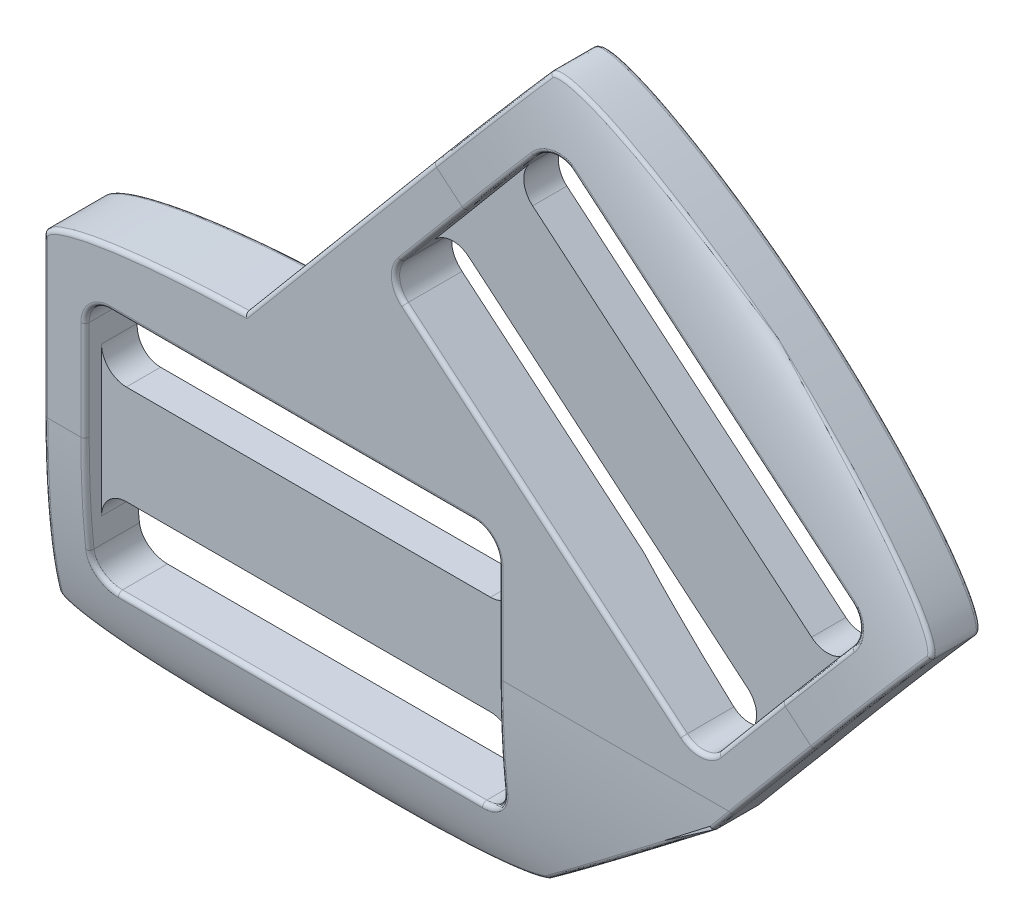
SolidWorks part; units mm, degrees
ref_plane "Ebene vorne" through (0, 0, 0) normal (0, 0, 1) x (1, 0, 0)
ref_plane "Ebene oben" through (0, 0, 0) normal (0, 1, 0) x (1, 0, 0)
ref_plane "Ebene rechts" through (0, 0, 0) normal (1, 0, 0) x (0, 0, -1)
sketch "Skizze1" plane through (0, 0, 0) normal (0, 0, 1) x (1, 0, 0)
  line L0 (24.1058, 7.0242) -> (7.2529, 21.1655)
  line L1 (4.7072, -0.5849) -> (-17.2928, -0.5849)
  line L2 (6.2072, 0.9151) -> (6.2072, 2.4151)
  line L3 (4.7072, 3.9151) -> (-17.2928, 3.9151)
  line L4 (-18.7928, 0.9151) -> (-18.7928, 2.4151)
  line L5 (-17.2928, -6.5849) -> (4.7072, -6.5849)
  line L6 (-18.7928, -8.0849) -> (-18.7928, -9.5849)
  line L7 (-17.2928, -11.0849) -> (4.7072, -11.0849)
  line L8 (6.2072, -8.0849) -> (6.2072, -9.5849)
  line L9 (19.1352, -5.1225) -> (8.217, -13.592)
  line L10 (-21.2928, 7.9151) -> (-21.2928, -15.0849)
  line L11 (-21.2928, -15.0849) -> (8.7072, -15.0849)
  line L12 (8.7072, 7.9151) -> (8.7072, -15.0849)
  line L13 (26.2191, 7.2091) -> (27.1833, 8.3581)
  line L14 (26.9984, 10.4714) -> (10.1454, 24.6127)
  line L15 (7.068, 23.2787) -> (8.0322, 24.4278)
  line L16 (3.3961, 16.5692) -> (20.2491, 2.4279)
  line L17 (1.2829, 16.3843) -> (0.3187, 15.2353)
  line L18 (0.5036, 13.122) -> (17.3566, -1.0193)
  line L19 (20.434, 0.3147) -> (19.4698, -0.8344)
  line L20 (9.6524, 30.248) -> (32.6337, 10.9644)
  line L21 (9.6524, 30.248) -> (-5.1317, 12.629)
  line L23 (32.6337, 10.9644) -> (17.8496, -6.6546)
  line L25 (-5.1317, 12.629) -> (-9.1172, 7.8793)
  arc A0 (4.7072, -11.0849) -> (6.2072, -9.5849) centre (4.7072, -9.5849) ccw
  arc A1 (4.7072, -6.5849) -> (6.2072, -8.0849) centre (4.7072, -8.0849) cw
  arc A2 (-18.7928, -9.5849) -> (-17.2928, -11.0849) centre (-17.2928, -9.5849) ccw
  arc A3 (-17.2928, -6.5849) -> (-18.7928, -8.0849) centre (-17.2928, -8.0849) ccw
  arc A4 (4.7072, -0.5849) -> (6.2072, 0.9151) centre (4.7072, 0.9151) ccw
  arc A5 (6.2072, 2.4151) -> (4.7072, 3.9151) centre (4.7072, 2.4151) ccw
  arc A6 (-17.2928, 3.9151) -> (-18.7928, 2.4151) centre (-17.2928, 2.4151) ccw
  arc A7 (-17.2928, -0.5849) -> (-18.7928, 0.9151) centre (-17.2928, 0.9151) cw
  arc A8 (17.3566, -1.0193) -> (19.4698, -0.8344) centre (18.3207, 0.1298) ccw
  arc A9 (20.2491, 2.4279) -> (20.434, 0.3147) centre (19.2849, 1.2788) cw
  arc A10 (0.3187, 15.2353) -> (0.5036, 13.122) centre (1.4678, 14.2711) ccw
  arc A11 (3.3961, 16.5692) -> (1.2829, 16.3843) centre (2.4319, 15.4202) ccw
  arc A12 (24.1058, 7.0242) -> (26.2191, 7.2091) centre (25.07, 8.1732) ccw
  arc A13 (27.1833, 8.3581) -> (26.9984, 10.4714) centre (26.0342, 9.3223) ccw
  arc A14 (10.1454, 24.6127) -> (8.0322, 24.4278) centre (9.1812, 23.4636) ccw
  arc A15 (7.2529, 21.1655) -> (7.068, 23.2787) centre (8.217, 22.3146) cw
  ellipse E0 centre (-6.2928, 5.9151) end of major axis (-21.2928, 5.9151) minor radius 2 (-6.2928, 7.9151) -> (-21.2928, 5.9151) ccw
  ellipse E2 centre (-6.2928, -13.0849) end of major axis (-21.2928, -13.0849) minor radius 2 (-6.2928, -15.0849) -> (-21.2928, -13.0849) cw
  ellipse E3 centre (-6.2928, -13.0849) end of major axis (8.7072, -13.0849) minor radius 2 (-6.2928, -15.0849) -> (8.7072, -13.0849) ccw
  ellipse E4 centre (19.8575, 19.0741) end of major axis (8.3668, 28.7159) minor radius 2 (21.143, 20.6062) -> (8.3668, 28.7159) ccw
  ellipse E5 centre (19.8575, 19.0741) end of major axis (8.3668, 28.7159) minor radius 2 (21.143, 20.6062) -> (31.3481, 9.4323) cw
  point P11 (6.2072, -11.0849)
  point P14 (6.2072, -6.5849)
  point P17 (-18.7928, -11.0849)
  point P22 (6.2072, -0.5849)
  point P25 (6.2072, 3.9151)
  point P28 (-18.7928, 3.9151)
  point P35 (-21.2928, 5.9151)
  point P36 (8.7072, 5.9151)
  point P37 (-6.2928, 7.9151)
  point P38 (-6.2928, -15.0849)
  point P39 (-21.2928, -13.0849)
  point P40 (8.7072, -13.0849)
  point P92 (8.3668, 28.7159)
  point P93 (31.3481, 9.4323)
  point P94 (21.143, 20.6062)
  point P95 (6.3589, 2.9872)
  point P96 (-3.8462, 14.1611)
  point P97 (19.1352, -5.1225)
  dimension "D6" = 1.5
  dimension "D17" = 1.5
  dimension "D31" = 5.5
  dimension "D1" = 4.5
  dimension "D2" = 4.5
  dimension "D3" = 25
  dimension "D4" = 25
  dimension "D5" = 6
  dimension "D8" = 4
  dimension "D9" = 2.5
  dimension "D10" = 2.5
  dimension "D11" = 2
  dimension "D12" = 2
  dimension "D13" = 2
  dimension "D14" = 2
  dimension "D15" = 2.5
  dimension "D16" = 6
  dimension "D18" = 4
  dimension "D20" = 2.5
  dimension "D21" = 2.5
  dimension "D22" = 2
  dimension "D23" = 2
  dimension "D24" = 2
  dimension "D25" = 2
  dimension "D26" = 2.5
  dimension "D27" = 2.5
  dimension "D28" = 4.5
  dimension "D29" = 4.5
sketch "Skizze2" plane through (0, 0, 0) normal (0, 0, 1) x (1, 0, 0)
  line L0 (24.1058, 7.0242) -> (7.2529, 21.1655)
  line L1 (4.7072, -0.5849) -> (-17.2928, -0.5849)
  line L2 (6.2072, 0.9151) -> (6.2072, 2.4151)
  line L3 (4.7072, 3.9151) -> (-17.2928, 3.9151)
  line L4 (-18.7928, 0.9151) -> (-18.7928, 2.4151)
  line L5 (-17.2928, -6.5849) -> (4.7072, -6.5849)
  line L6 (-18.7928, -8.0849) -> (-18.7928, -9.5849)
  line L7 (-17.2928, -11.0849) -> (4.7072, -11.0849)
  line L8 (6.2072, -8.0849) -> (6.2072, -9.5849)
  line L9 (-21.2928, 7.9151) -> (8.7072, 7.9151)
  line L10 (-21.2928, 7.9151) -> (-21.2928, -15.0849)
  line L11 (-21.2928, -15.0849) -> (8.7072, -15.0849)
  line L12 (8.7072, 7.9151) -> (8.7072, -15.0849)
  line L13 (26.2191, 7.2091) -> (27.1833, 8.3581)
  line L14 (26.9984, 10.4714) -> (10.1454, 24.6127)
  line L15 (7.068, 23.2787) -> (8.0322, 24.4278)
  line L16 (3.3961, 16.5692) -> (20.2491, 2.4279)
  line L17 (1.2829, 16.3843) -> (0.3187, 15.2353)
  line L18 (0.5036, 13.122) -> (17.3566, -1.0193)
  line L19 (20.434, 0.3147) -> (19.4698, -0.8344)
  line L20 (9.6524, 30.248) -> (32.6337, 10.9644)
  line L21 (9.6524, 30.248) -> (-5.1317, 12.629)
  line L22 (-5.1317, 12.629) -> (17.8496, -6.6546)
  line L23 (32.6337, 10.9644) -> (17.8496, -6.6546)
  line L24 (8.7072, -13.0849) -> (19.1352, -5.1225)
  line L25 (-5.1317, 12.629) -> (-9.1172, 7.8793)
  arc A0 (4.7072, -11.0849) -> (6.2072, -9.5849) centre (4.7072, -9.5849) ccw
  arc A1 (4.7072, -6.5849) -> (6.2072, -8.0849) centre (4.7072, -8.0849) cw
  arc A2 (-18.7928, -9.5849) -> (-17.2928, -11.0849) centre (-17.2928, -9.5849) ccw
  arc A3 (-17.2928, -6.5849) -> (-18.7928, -8.0849) centre (-17.2928, -8.0849) ccw
  arc A4 (4.7072, -0.5849) -> (6.2072, 0.9151) centre (4.7072, 0.9151) ccw
  arc A5 (6.2072, 2.4151) -> (4.7072, 3.9151) centre (4.7072, 2.4151) ccw
  arc A6 (-17.2928, 3.9151) -> (-18.7928, 2.4151) centre (-17.2928, 2.4151) ccw
  arc A7 (-17.2928, -0.5849) -> (-18.7928, 0.9151) centre (-17.2928, 0.9151) cw
  arc A8 (17.3566, -1.0193) -> (19.4698, -0.8344) centre (18.3207, 0.1298) ccw
  arc A9 (20.2491, 2.4279) -> (20.434, 0.3147) centre (19.2849, 1.2788) cw
  arc A10 (0.3187, 15.2353) -> (0.5036, 13.122) centre (1.4678, 14.2711) ccw
  arc A11 (3.3961, 16.5692) -> (1.2829, 16.3843) centre (2.4319, 15.4202) ccw
  arc A12 (24.1058, 7.0242) -> (26.2191, 7.2091) centre (25.07, 8.1732) ccw
  arc A13 (27.1833, 8.3581) -> (26.9984, 10.4714) centre (26.0342, 9.3223) ccw
  arc A14 (10.1454, 24.6127) -> (8.0322, 24.4278) centre (9.1812, 23.4636) ccw
  arc A15 (7.2529, 21.1655) -> (7.068, 23.2787) centre (8.217, 22.3146) cw
  ellipse E0 centre (-6.2928, 5.9151) end of major axis (-21.2928, 5.9151) minor radius 2 (-6.2928, 7.9151) -> (-21.2928, 5.9151) ccw
  ellipse E1 centre (-6.2928, 5.9151) end of major axis (8.7072, 5.9151) minor radius 2 (-6.2928, 7.9151) -> (8.7072, 5.9151) cw
  ellipse E2 centre (-6.2928, -13.0849) end of major axis (-21.2928, -13.0849) minor radius 2 (-6.2928, -15.0849) -> (-21.2928, -13.0849) cw
  ellipse E3 centre (-6.2928, -13.0849) end of major axis (8.7072, -13.0849) minor radius 2 (-6.2928, -15.0849) -> (8.7072, -13.0849) ccw
  ellipse E4 centre (19.8575, 19.0741) end of major axis (8.3668, 28.7159) minor radius 2 (21.143, 20.6062) -> (8.3668, 28.7159) ccw
  ellipse E5 centre (19.8575, 19.0741) end of major axis (8.3668, 28.7159) minor radius 2 (21.143, 20.6062) -> (31.3481, 9.4323) cw
  ellipse E6 centre (7.6445, 4.5193) end of major axis (-3.8462, 14.1611) minor radius 2 (6.3589, 2.9872) -> (-3.8462, 14.1611) cw
  ellipse E7 centre (7.6445, 4.5193) end of major axis (-3.8462, 14.1611) minor radius 2 (6.3589, 2.9872) -> (19.1352, -5.1225) ccw
  point P11 (6.2072, -11.0849)
  point P14 (6.2072, -6.5849)
  point P17 (-18.7928, -11.0849)
  point P22 (6.2072, -0.5849)
  point P25 (6.2072, 3.9151)
  point P28 (-18.7928, 3.9151)
  point P35 (-21.2928, 5.9151)
  point P36 (8.7072, 5.9151)
  point P37 (-6.2928, 7.9151)
  point P38 (-6.2928, -15.0849)
  point P39 (-21.2928, -13.0849)
  point P40 (8.7072, -13.0849)
  point P92 (8.3668, 28.7159)
  point P93 (31.3481, 9.4323)
  point P94 (21.143, 20.6062)
  point P95 (6.3589, 2.9872)
  point P96 (-3.8462, 14.1611)
  point P97 (19.1352, -5.1225)
  dimension "D6" = 1.5
  dimension "D17" = 1.5
  dimension "D31" = 5.5
  dimension "D1" = 4.5
  dimension "D2" = 4.5
  dimension "D3" = 25
  dimension "D4" = 25
  dimension "D5" = 6
  dimension "D7" = 4
  dimension "D8" = 4
  dimension "D9" = 2.5
  dimension "D10" = 2.5
  dimension "D11" = 2
  dimension "D12" = 2
  dimension "D13" = 2
  dimension "D14" = 2
  dimension "D15" = 2.5
  dimension "D16" = 6
  dimension "D18" = 4
  dimension "D19" = 4
  dimension "D20" = 2.5
  dimension "D21" = 2.5
  dimension "D22" = 2
  dimension "D23" = 2
  dimension "D24" = 2
  dimension "D25" = 2
  dimension "D26" = 2.5
  dimension "D27" = 2.5
  dimension "D28" = 4.5
  dimension "D29" = 4.5
  dimension "D30" = 50
extrude "Aufsatz-Linear austragen4" add sketch "Skizze1" along normal blind 5
sketch "Skizze4" plane through (0, 0, 5) normal (0, 0, 1) x (1, 0, 0)
  line L0 (-18.7928, 0.9151) -> (-18.7928, 2.4151) construction
  line L1 (-18.7928, 1.6651) -> (6.2072, 1.6651)
  line L2 (-18.7928, 1.6651) -> (-18.7928, -8.8349)
  line L3 (-18.7928, -8.8349) -> (6.2072, -8.8349)
  line L4 (6.2072, 1.6651) -> (6.2072, -8.8349)
  line L5 (6.2072, -8.0849) -> (6.2072, -9.5849) construction
  line L6 (7.5501, 23.8533) -> (26.7012, 7.7836)
  line L7 (7.068, 23.2787) -> (8.0322, 24.4278) construction
  line L8 (26.2191, 7.2091) -> (27.1833, 8.3581) construction
  line L9 (26.7012, 7.7836) -> (19.9519, -0.2599)
  line L10 (20.434, 0.3147) -> (19.4698, -0.8344) construction
  line L11 (19.9519, -0.2599) -> (0.8008, 15.8098)
  line L12 (1.2829, 16.3843) -> (0.3187, 15.2353) construction
  line L13 (0.8008, 15.8098) -> (7.5501, 23.8533)
extrude "Schnitt-Linear austragen1" cut sketch "Skizze4" against normal blind 1
sketch "Skizze5" plane through (-9.23, 7.7449, 0) normal (-0.766, 0.6428, 0) x (0, 0, 1)
  line L0 (0, 29.3758) -> (0, 6.3758)
  line L1 (0, 29.3758) -> (0, 6.3758) construction
  line L2 (0, 29.3758) -> (5, 29.3758)
  line L3 (5, 29.3758) -> (5, 6.3758)
  line L4 (5, 6.3758) -> (0, 6.3758)
  ellipse E0 centre (0, 17.8758) end of major axis (0, 29.3758) minor radius 2 (0, 29.3758) -> (0, 6.3758) cw
  ellipse E1 centre (3, 17.8758) end of major axis (3, 29.3758) minor radius 2 (3, 29.3758) -> (5, 17.8758) cw
  point P5 (2, 17.8758)
  point P7 (3, 29.3758)
  point P14 (3, 17.8758)
  dimension "D1" = 2
  dimension "D2" = 5
  dimension "D3" = 2
extrude "Schnitt-Linear austragen2" cut sketch "Skizze5" against normal blind 40 contours E0 M6 M3 | E0 L0 M6 | L2 E1 L3 M6 | E1 L3 M6
sketch "Skizze6" plane through (-21.2928, 0, 0) normal (-1, 0, 0) x (0, 0, 1)
  line L0 (0, 7.9151) -> (0, -15.0849)
  line L1 (0, 7.9151) -> (0, -15.0849) construction
  line L2 (0, -15.0849) -> (5, -15.0849)
  line L3 (5, -15.0849) -> (5, 7.9151)
  line L4 (5, 7.9151) -> (0, 7.9151)
  ellipse E0 centre (0, -3.5849) end of major axis (0, 7.9151) minor radius 2 (0, -15.0849) -> (0, 7.9151) ccw
  ellipse E1 centre (3, -3.5849) end of major axis (3, 7.9151) minor radius 2 (3, -15.0849) -> (5, -3.5849) ccw
  point P5 (2, -3.5849)
  point P8 (3, -3.5849)
  dimension "D1" = 5
  dimension "D2" = 2
  dimension "D3" = 2
extrude "Schnitt-Linear austragen5" cut sketch "Skizze6" against normal blind 56 contours E0 M5 M7 M4 | L0 E0 M5 | E0 L0 M7 | E1 L2 L3 M5 | E1 M5 M6
sketch "Skizze7" plane through (-9.23, 7.7449, 0) normal (-0.766, 0.6428, 0) x (0, 0, 1)
  line L0 (0.1576, 0.1754) -> (0.3021, 6.5077)
  line L1 (0.3021, 6.5077) -> (-0.2053, 6.5077)
  line L2 (-0.2053, 6.5077) -> (-0.2053, 0.1754)
  line L3 (-0.2053, 0.1754) -> (0.1576, 0.1754)
  ellipse E0 centre (0, 17.8758) end of major axis (0, 29.3758) minor radius 2 (0, 6.3758) -> (1.1271, 27.3758) ccw construction
extrude "Schnitt-Linear austragen7" cut sketch "Skizze7" against normal blind 8
fillet "Verrundung9" radius 0.25 2 edges at (12.0587, -10.6119, 1.5832) (12.0587, -10.6119, 4.5832)
fillet "Verrundung10" radius 0.25 14 edges at (-17.855, 7.1892, 5) (-21.2928, 1.1651, 5) (-21.2928, -3.5849, 2) (-19.6276, 6.8309, 0.8477) (-18.2254, -14.2968, 0.7276) (-18.2254, -14.2968, 3.7276) (-21.2928, -8.9572, 4.7684) (3.9658, -14.5441, 0.6061) (8.217, -13.592, 2.5436) (3.9658, -14.5441, 3.6061) (8.1902, -13.6055, 3.8328) (8.175, -13.613, 1.2272) (8.5274, -13.0968, 4.124)
fillet "Verrundung11" radius 0.25 20 edges at (-0.0265, 14.1404, 5) (2.2471, 17.5334, 5) (6.1788, 22.219, 4.9252) (8.8923, 24.9355, 4.5945) (18.5719, 17.542, 4.5161) (27.5031, 9.6261, 4.5627) (25.3299, 6.1493, 4.9252) (21.3982, 1.4637, 5) (18.4515, -1.3645, 5) (-18.4603, -10.5267, 4.5945) (-18.7928, -6.7016, 4.9252) (-18.7928, -0.5849, 5) (-18.3535, 3.4757, 5) (-6.2928, 3.9151, 5) (5.7678, 3.4757, 5) (6.2072, -0.5849, 5) (6.2072, -6.7016, 4.9252) (5.6371, -10.7619, 4.5627) (8.9301, 6.0514, 5) (-6.2928, -11.0849, 4.5161)
fillet "Verrundung12" radius 0.25 15 edges at (0.6217, 19.4857, 1.9502) (9.6582, 28.5984, 0.9102) (27.7263, 5.116, 1.8836) (21.3183, -2.5208, 1.9914) (19.1658, -5.086, 2.1667) (19.1352, -5.1225, 3.4864) (19.2533, -4.9817, 4.8723) (22.8335, -0.715, 5) (28.6948, 6.2702, 4.7684) (9.6582, 28.5984, 3.9102) (5.7135, 25.5539, 4.7684) (29.7773, 12.3324, 0.7276) (29.7773, 12.3324, 3.7276) (-3.5358, 14.531, 5)
fillet "Verrundung13" radius 0.25 4 edges at (-8.4829, 7.875, 0.1669) (-2.0034, 10.1763, 0.3021) (-5.0371, 12.6123, 0.3002) (-7.1808, 10.187, 0.2263)
